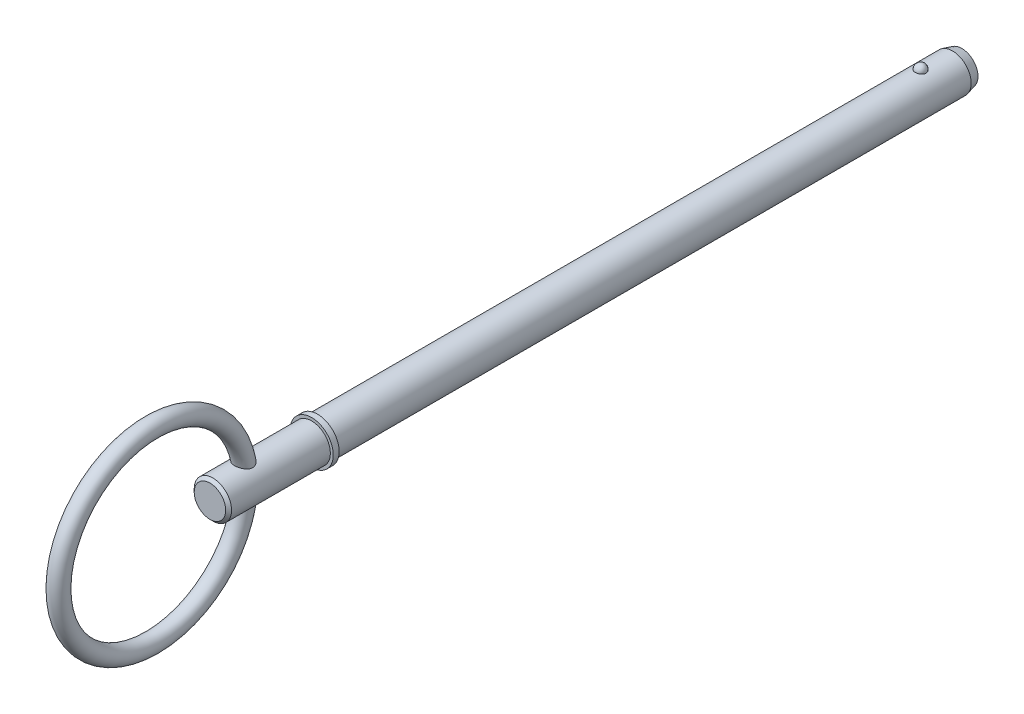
SolidWorks part; units mm, degrees
ref_plane "Front Plane" through (0, 0, 0) normal (0, 0, 1) x (1, 0, 0)
ref_plane "Top Plane" through (0, 0, 0) normal (0, 1, 0) x (1, 0, 0)
ref_plane "Right Plane" through (0, 0, 0) normal (1, 0, 0) x (0, 0, -1)
sketch "Sketch2" plane through (0, 0, 0) normal (0, 0, 1) x (1, 0, 0)
  circle A0 centre (0, 0) radius 3.175
  point P3 (0, 3.175)
  dimension "D1" = 6.35
extrude "Boss-Extrude1" add sketch "Sketch2" along normal blind 101.6
sketch "Sketch3" plane through (0, 0, 0) normal (0, 0, -1) x (-1, 0, 0)
  circle A0 centre (0, 0) radius 3.175
  dimension "D1" = 6.35
extrude "Boss-Extrude2" add sketch "Sketch3" along normal blind 7.92
chamfer "Chamfer1" distance 1.586 angle 15 1 edges at (-3.175, 0, -7.92)
sketch "Sketch18" plane through (0, 0, 0) normal (1, 0, 0) x (0, 0, -1)
  line L0 (6.334, 3.175) -> (-101.6, 3.175) construction
  line L1 (0.91, 4.085) -> (0.91, 2.265)
  line L2 (-101.6, -3.175) -> (6.334, -3.175) construction
  arc A0 (0.91, 4.085) -> (0.91, 2.265) centre (0.91, 3.175) ccw
  point P4 (0, 3.175)
  dimension "D1" = 7.26
revolve "Revolve1" add sketch "Sketch18" angle 360 about L1
sketch "Sketch19" plane through (0, 0, 0) normal (1, 0, 0) x (0, 0, -1)
  line L0 (-33.7288, 0) -> (-46.4542, 0) construction
sketch "Sketch20" plane through (0, 0, 0) normal (1, 0, 0) x (0, 0, -1)
  line L0 (-101.6, 0) -> (-101.6, 3.675)
  line L1 (-101.6, 3.175) -> (-101.6, -3.175) construction
  line L2 (-101.6, 3.675) -> (-102.6, 3.675)
  line L3 (-102.6, 3.675) -> (-102.6, 0)
  line L4 (-33.7288, 0) -> (-46.4542, 0) construction
  line L5 (-102.6, 0) -> (-101.6, 0)
  dimension "D1" = 3.675
  dimension "D2" = 1
revolve "Revolve2" add sketch "Sketch20" angle 360 about L0
sketch "Sketch21" plane through (0, 0, 101.6) normal (0, 0, -1) x (-1, 0, 0)
  circle A0 centre (0, 0) radius 3.175
  dimension "D1" = 6.35
extrude "Boss-Extrude3" add sketch "Sketch21" against normal blind 18.29
chamfer "Chamfer2" distance 0.5 angle 45 1 edges at (-3.175, 0, 119.89)
sketch "Sketch23" plane through (0, 0, 0) normal (1, 0, 0) x (0, 0, -1)
  line L0 (-119.89, 2.675) -> (-119.89, -2.675) construction
  circle A0 centre (-129.765, 0) radius 15.875
  point P2 (-113.89, 0)
  dimension "D1" = 31.75
  dimension "D2" = 6
sketch "Sketch24" plane through (0, 0, 0) normal (0, 1, 0) x (1, 0, 0)
  circle A0 centre (0, -113.89) radius 1.5
  dimension "D1" = 3
sweep "Sweep1" add profiles "Sketch24" path "Sketch23"
